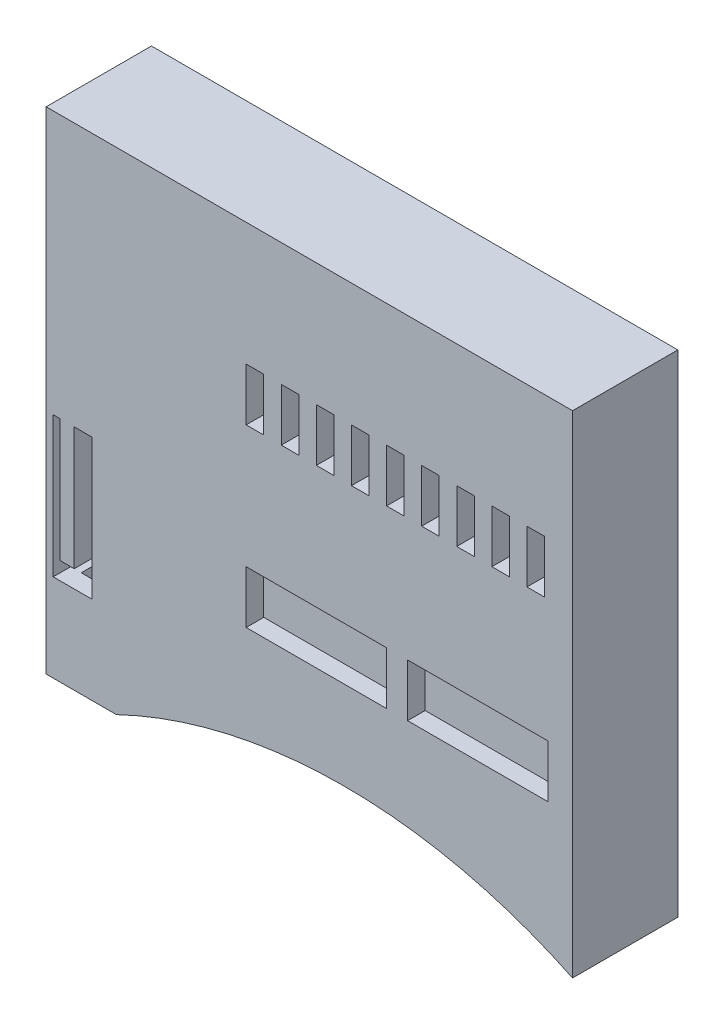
SolidWorks part; units mm, degrees
ref_plane "前视基准面" through (0, 0, 0) normal (0, 0, 1) x (1, 0, 0)
ref_plane "上视基准面" through (0, 0, 0) normal (0, 1, 0) x (1, 0, 0)
ref_plane "右视基准面" through (0, 0, 0) normal (1, 0, 0) x (0, 0, -1)
sketch "草图1" plane through (0, 0, 0) normal (0, 0, 1) x (1, 0, 0)
  line L1 (-7.5, 7) -> (7.5, 7)
  line L2 (-7.5, 7) -> (-7.5, -7)
  line L3 (-7.5, -7) -> (7.5, -7)
  line L4 (7.5, 7) -> (7.5, -7)
  line L5 (-7.5, 7) -> (7.5, -7) construction
  line L6 (-7.5, -7) -> (7.5, 7) construction
  point P0 (0, 0)
  dimension "D1" = 14
  dimension "D2" = 15
extrude "凸台-拉伸1" add sketch "草图1" along normal blind 3
shell "抽壳1" thickness 0.5
sketch "草图2" plane through (0, 0, 3) normal (0, 0, 1) x (1, 0, 0)
  line L0 (0, 11.9845) -> (0, -15.4925) construction
  line L1 (2.5, 11.1353) -> (2.5, -14.0975) construction
  line L2 (7.5, -7) -> (7.5, 7) construction
  line L3 (-7.5, -7) -> (7.5, -7) construction
  line L5 (-5.5, -7) -> (7.5, -7)
  line L6 (6.8, -1.5) -> (6.8, -3)
  line L7 (-1.8, -1.5) -> (2.2, -1.5)
  line L8 (-1.8, -1.5) -> (-1.8, -3)
  line L9 (-1.8, -3) -> (2.2, -3)
  line L10 (2.2, -1.5) -> (2.2, -3)
  line L11 (6.8, -1.5) -> (2.8, -1.5)
  line L12 (2.8, -1.5) -> (2.8, -3)
  line L13 (6.8, -3) -> (2.8, -3)
  line L14 (-7.5, 7) -> (-7.5, -7) construction
  arc A0 (-5.5, -7) -> (7.5, -7) centre (1, -20.5185) cw
  dimension "D3" = 2
  dimension "D2" = 15
  dimension "D1" = 5
  dimension "D4" = 1.5
  dimension "D5" = 4
  dimension "D6" = 0.3
  dimension "D7" = 4
extrude "切除-拉伸1" cut sketch "草图2" against normal up to vertex
sketch "草图3" plane through (0, 0, 3) normal (0, 0, 1) x (1, 0, 0)
  line L0 (-7.5, 7) -> (-7.5, -7) construction
  line L1 (-1.8, 3.5) -> (-1.3, 3.5)
  line L2 (-1.8, 3.5) -> (-1.8, 2)
  line L3 (-1.8, 2) -> (-1.3, 2)
  line L4 (-1.3, 3.5) -> (-1.3, 2)
  line L5 (7.5, 7) -> (-7.5, 7) construction
  line L6 (-0.8, 3.5) -> (-0.8, 2)
  line L7 (-0.3, 3.5) -> (-0.3, 2)
  line L8 (-0.8, 3.5) -> (-0.3, 3.5)
  line L9 (-0.8, 2) -> (-0.3, 2)
  line L10 (0.2, 3.5) -> (0.2, 2)
  line L11 (0.7, 3.5) -> (0.7, 2)
  line L12 (0.2, 3.5) -> (0.7, 3.5)
  line L13 (0.2, 2) -> (0.7, 2)
  line L14 (1.2, 3.5) -> (1.2, 2)
  line L15 (1.7, 3.5) -> (1.7, 2)
  line L16 (1.2, 3.5) -> (1.7, 3.5)
  line L17 (1.2, 2) -> (1.7, 2)
  line L18 (2.2, 3.5) -> (2.2, 2)
  line L19 (2.7, 3.5) -> (2.7, 2)
  line L20 (2.2, 3.5) -> (2.7, 3.5)
  line L21 (2.2, 2) -> (2.7, 2)
  line L22 (3.2, 3.5) -> (3.2, 2)
  line L23 (3.7, 3.5) -> (3.7, 2)
  line L24 (3.2, 3.5) -> (3.7, 3.5)
  line L25 (3.2, 2) -> (3.7, 2)
  line L26 (4.2, 3.5) -> (4.2, 2)
  line L27 (4.7, 3.5) -> (4.7, 2)
  line L28 (4.2, 3.5) -> (4.7, 3.5)
  line L29 (4.2, 2) -> (4.7, 2)
  line L30 (5.2, 3.5) -> (5.2, 2)
  line L31 (5.7, 3.5) -> (5.7, 2)
  line L32 (5.2, 3.5) -> (5.7, 3.5)
  line L33 (5.2, 2) -> (5.7, 2)
  line L34 (6.2, 3.5) -> (6.2, 2)
  line L35 (6.7, 3.5) -> (6.7, 2)
  line L36 (6.2, 3.5) -> (6.7, 3.5)
  line L37 (6.2, 2) -> (6.7, 2)
  dimension "D1" = 1.5
  dimension "D2" = 0.5
  dimension "D3" = 5.7
  dimension "D4" = 3.5
  dimension "D5" = 9
extrude "切除-拉伸2" cut sketch "草图3" against normal blind 10
sketch "草图4" plane through (0, 0, 3) normal (0, 0, 1) x (1, 0, 0)
  line L0 (-6.5817, -4.5) -> (-7.3, -4.5)
  line L1 (-7.3, -4.5) -> (-7.3, -0.5)
  line L2 (-7.3, -0.5) -> (-7.1, -0.5)
  line L3 (-7.1, -0.5) -> (-7.1, -4)
  line L4 (-7.1, -4) -> (-6.7, -4)
  line L5 (-6.7, -4) -> (-6.7, -0.5)
  line L6 (-6.7, -0.5) -> (-6.2, -0.5)
  line L7 (-6.2, -0.5) -> (-6.2, -4.5)
  line L8 (-6.2, -4.5) -> (-6.5817, -4.5)
  line L9 (-7.5, 7) -> (-7.5, -7) construction
  line L10 (-7.5, -7) -> (-5.5, -7) construction
  point P13 (-6.3908, -4.5)
  dimension "D1" = 0.2
  dimension "D2" = 0.2
  dimension "D3" = 0.5
  dimension "D4" = 0.4
  dimension "D5" = 2.5
  dimension "D6" = 0.5
  dimension "D7" = 4
  dimension "D8" = 4
extrude "切除-拉伸3" cut sketch "草图4" against normal through all
